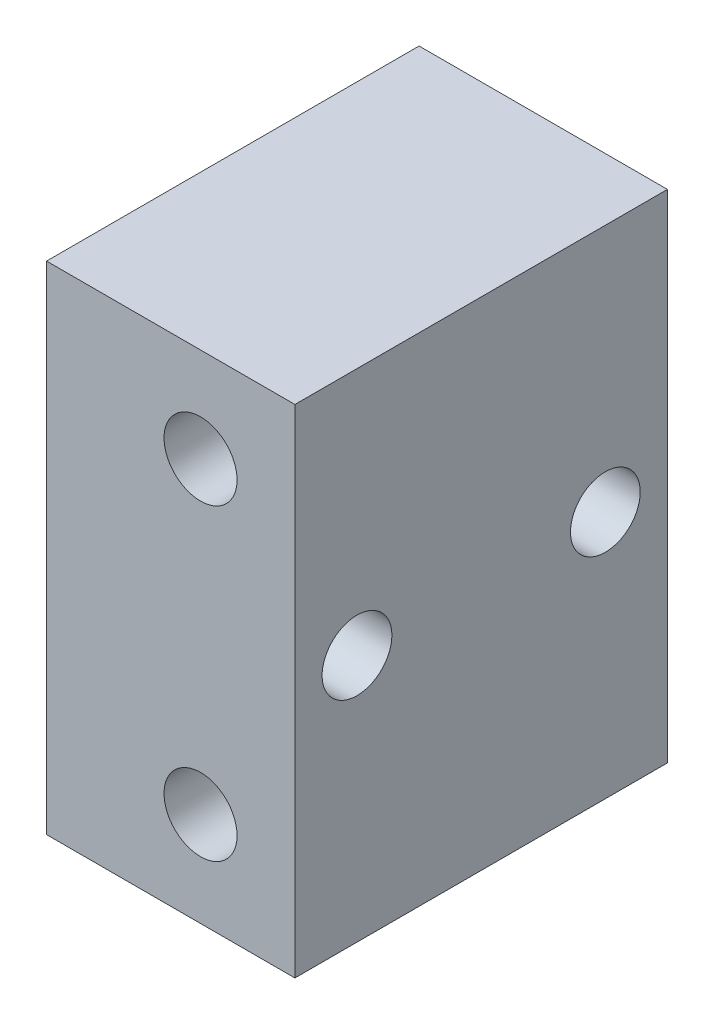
SolidWorks part; units mm, degrees
ref_plane "Front Plane" through (0, 0, 0) normal (0, 0, 1) x (1, 0, 0)
ref_plane "Top Plane" through (0, 0, 0) normal (0, 1, 0) x (1, 0, 0)
ref_plane "Right Plane" through (0, 0, 0) normal (1, 0, 0) x (0, 0, -1)
sketch "Sketch1" plane through (0, 0, 0) normal (0, 0, 1) x (1, 0, 0)
  line L1 (0, 0) -> (12.7, 0)
  line L2 (0, 0) -> (0, 25.4)
  line L3 (0, 25.4) -> (12.7, 25.4)
  line L4 (12.7, 0) -> (12.7, 25.4)
  dimension "D1" = 25.4
  dimension "D2" = 12.7
extrude "Extrude1" add sketch "Sketch1" along normal blind 19.05
sketch "Sketch2" plane through (12.7, 0, 0) normal (1, 0, 0) x (0, 0, -1)
  line L0 (-19.05, 0) -> (-19.05, 25.4) construction
  line L1 (-19.05, 12.7) -> (0, 12.7) construction
  line L2 (0, 0) -> (0, 25.4) construction
  point P0 (-15.875, 12.7)
  point P1 (-3.175, 12.7)
  dimension "D1" = 3.175
  dimension "D2" = 12.7
hole_wizard "#28 (0.1405) Diameter Hole1" positions "3DSketch1" profile "Sketch3" hole size "#28" standard "Ansi Inch"
sketch3d "3DSketch1"
  point P0 (12.7, 12.7, 15.875)
  point P4 (12.7, 12.7, 3.175)
sketch "Sketch3" plane through (12.7, 12.7, 15.875) normal (0, 1, 0) x (0, 0, -1)
  line L0 (0, 0) -> (0, 12.7)
  line L1 (0, 12.7) -> (1.7843, 12.7)
  line L2 (1.7843, 12.7) -> (1.7843, 0)
  line L5 (1.7843, 0) -> (0, 0)
  line L11 (0, -6.35) -> (0, 107.95) construction
  dimension "Thru Hole Dia." = 3.5687
  dimension "Thru Hole Depth" = 12.7
sketch "Sketch4" plane through (0, 0, 19.05) normal (0, 0, 1) x (1, 0, 0)
  line L1 (0, 12.7) -> (12.7, 12.7) construction
  line L2 (0, 25.4) -> (0, 0) construction
  line L3 (12.7, 0) -> (12.7, 25.4) construction
  point P0 (7.874, 20.574)
  point P1 (7.874, 4.826)
  dimension "D1" = 7.874
  dimension "D2" = 15.748
  dimension "D3" = 7.874
hole_wizard "#26 (0.147) Diameter Hole1" positions "3DSketch2" profile "Sketch5" hole size "#26" standard "Ansi Inch"
sketch3d "3DSketch2"
  point P0 (7.874, 20.574, 19.05)
  point P3 (7.874, 4.826, 19.05)
sketch "Sketch5" plane through (7.874, 20.574, 19.05) normal (1, 0, 0) x (0, -1, 0)
  line L0 (0, 0) -> (0, 19.05)
  line L1 (0, 19.05) -> (1.8669, 19.05)
  line L2 (1.8669, 19.05) -> (1.8669, 0)
  line L5 (1.8669, 0) -> (0, 0)
  line L11 (0, -6.35) -> (0, 107.95) construction
  dimension "Thru Hole Dia." = 3.7338
  dimension "Thru Hole Depth" = 19.05
equation "\"D1@Sketch4\" = \"D2@Sketch4\"/2"
